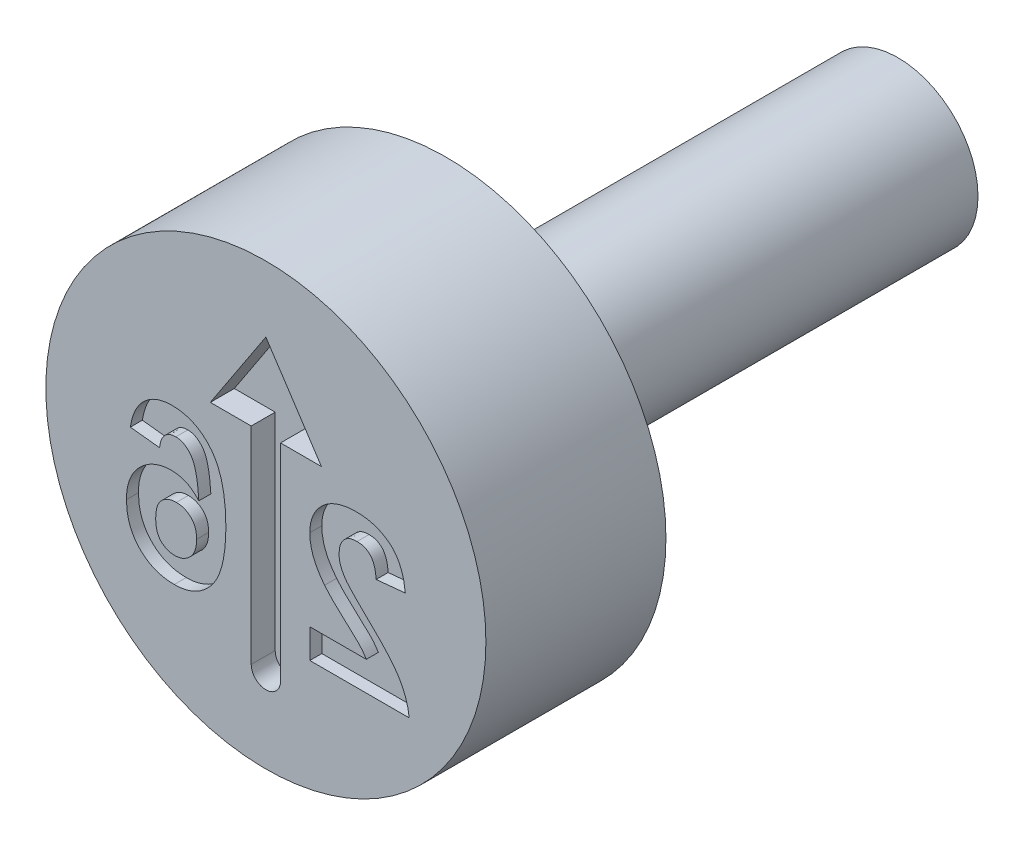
SolidWorks part; units mm, degrees
ref_plane "Front Plane" through (0, 0, 0) normal (0, 0, 1) x (1, 0, 0)
ref_plane "Top Plane" through (0, 0, 0) normal (0, 1, 0) x (1, 0, 0)
ref_plane "Right Plane" through (0, 0, 0) normal (1, 0, 0) x (0, 0, -1)
sketch "Sketch2" plane through (0, 0, 0) normal (1, 0, 0) x (0, 0, -1)
  line L0 (0.4039, 0) -> (50000.4039, 0) construction
  line L6 (0, 5.5) -> (0, 0)
  line L7 (4.5, 5.5) -> (0, 5.5)
  line L8 (4.5, 2) -> (4.5, 5.5)
  line L9 (15.8, 2) -> (4.5, 2)
  line L10 (15.8, 0) -> (15.8, 2)
  line L11 (0, 0) -> (15.8, 0)
  dimension "D1" = 11
  dimension "D2" = 4
  dimension "D3" = 15.8
  dimension "D4" = 4.5
revolve "Revolve1" add sketch "Sketch2" angle 360 about L0
sketch "Sketch3" plane through (0, 0, 0) normal (0, 0, 1) x (1, 0, 0)
  line L0 (0, 0) -> (0, 192375) construction
  line L1 (0.3664, 1.7436) -> (0.3664, -3.4169)
  line L2 (1.3888, 1.7436) -> (0.3664, 1.7436)
  line L3 (0, 3.8516) -> (1.3888, 1.7436)
  line L15 (0, 3.8516) -> (-1.3888, 1.7436)
  line L16 (-1.3888, 1.7436) -> (-0.3664, 1.7436)
  line L17 (-0.3664, 1.7436) -> (-0.3664, -3.4169)
  arc A2 (-0.3664, -3.4169) -> (0.3664, -3.4169) centre (0, -3.4169) ccw
extrude "Cut-Extrude4" cut sketch "Sketch3" against normal blind 0.6
sketch "Sketch4" plane through (0, 0, 0) normal (0, 0, 1) x (1, 0, 0)
  text T0 "2  6" font "Arial" height 3.8
  dimension "D1" = 2.6
extrude "Cut-Extrude5" cut sketch "Sketch4" against normal blind 0.3
